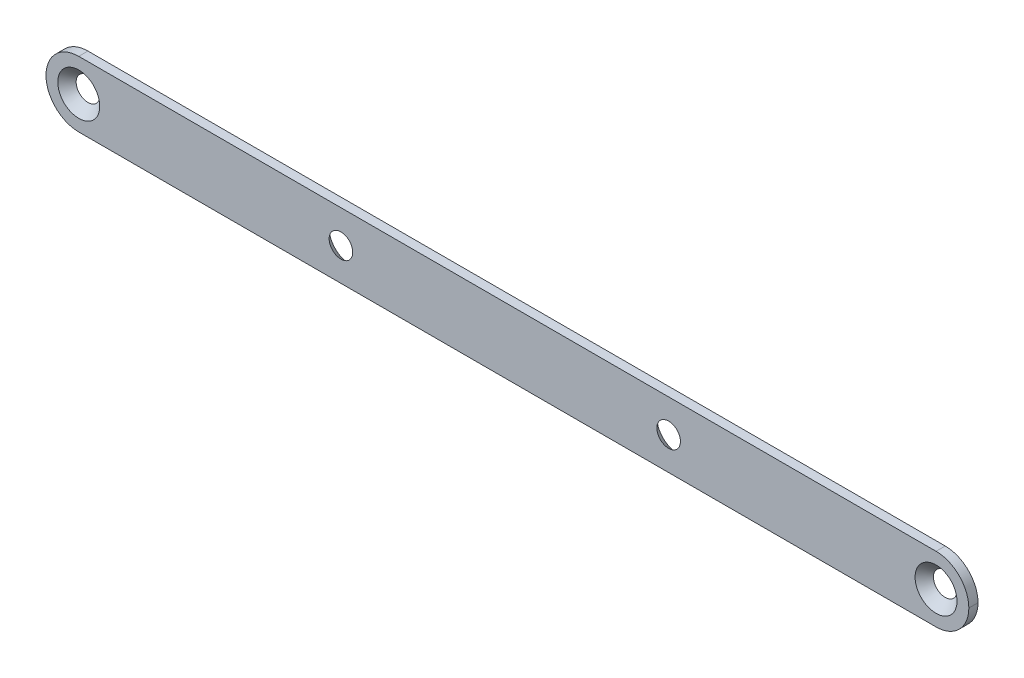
SolidWorks part; units mm, degrees
ref_plane "Front Plane" through (0, 0, 0) normal (0, 0, 1) x (1, 0, 0)
ref_plane "Top Plane" through (0, 0, 0) normal (0, 1, 0) x (1, 0, 0)
ref_plane "Right Plane" through (0, 0, 0) normal (1, 0, 0) x (0, 0, -1)
sketch "Sketch1" plane through (0, 0, 0) normal (0, 0, 1) x (1, 0, 0)
  line L1 (-21.9446, 5.3571) -> (118.8554, 5.3571)
  line L2 (-21.9446, 5.3571) -> (-21.9446, -4.6429)
  line L3 (-21.9446, -4.6429) -> (118.8554, -4.6429)
  line L4 (118.8554, 5.3571) -> (118.8554, -4.6429)
  circle A0 centre (-16.9446, 0.3571) radius 1.7
  circle A1 centre (113.8554, 0.3571) radius 1.7
  circle A2 centre (23.0554, 0.3571) radius 1.7
  circle A3 centre (73.0554, 0.3571) radius 1.7
  dimension "D3" = 3.4
  dimension "D4" = 3.4
  dimension "D9" = 3.4
  dimension "D10" = 3.4
  dimension "D1" = 10
  dimension "D2" = 140.8
  dimension "D5" = 5
  dimension "D6" = 5
  dimension "D7" = 5
  dimension "D8" = 5
  dimension "D11" = 5
  dimension "D12" = 5
  dimension "D13" = 50
  dimension "D14" = 40
extrude "Boss-Extrude1" add sketch "Sketch1" along normal blind 1.4
hole_wizard "CSK for M3 Flat Head Machine Screw1" positions "Sketch2" profile "Sketch3" countersink size "M3" standard "ANSI Metric"
sketch "Sketch2" plane through (0, 0, 1.4) normal (0, 0, 1) x (1, 0, 0)
  point P0 (-16.9446, 0.3571)
  point P3 (113.8554, 0.3571)
sketch "Sketch3" plane through (-16.9446, 0.3571, 1.4) normal (1, 0, 0) x (0, -1, 0)
  line L0 (0, 0) -> (0, 15.0215)
  line L1 (0, 15.0215) -> (1.7, 14)
  line L2 (1.7, 14) -> (1.7, 1.5)
  line L3 (1.7, 1.5) -> (3.2, 0)
  line L5 (3.2, 0) -> (0, 0)
  line L6 (-1.7, 1.5) -> (-3.2, 0) construction
  line L10 (0, 15.0215) -> (-1.7, 14) construction
  line L11 (0, -6.35) -> (0, 107.95) construction
  dimension "Hole Dia." = 3.4
  dimension "Hole Depth" = 14
  dimension "Near C'Sink Dia." = 6.4
  dimension "Near C'Sink Angle" = 90
  dimension "Drill Angle" = 118
hole_wizard "CSK for M3 Flat Head Machine Screw2" positions "Sketch4" profile "Sketch5" countersink size "M3" standard "ANSI Metric"
sketch "Sketch4" plane through (0, 0, 0) normal (0, 0, -1) x (-1, 0, 0)
  point P0 (-73.0554, 0.3571)
  point P3 (-23.0554, 0.3571)
sketch "Sketch5" plane through (73.0554, 0.3571, 0) normal (1, 0, 0) x (0, 1, 0)
  line L0 (0, 0) -> (0, 15.0215)
  line L1 (0, 15.0215) -> (1.7, 14)
  line L2 (1.7, 14) -> (1.7, 1.5)
  line L3 (1.7, 1.5) -> (3.2, 0)
  line L5 (3.2, 0) -> (0, 0)
  line L6 (-1.7, 1.5) -> (-3.2, 0) construction
  line L10 (0, 15.0215) -> (-1.7, 14) construction
  line L11 (0, -6.35) -> (0, 107.95) construction
  dimension "Hole Dia." = 3.4
  dimension "Hole Depth" = 14
  dimension "Near C'Sink Dia." = 6.4
  dimension "Near C'Sink Angle" = 90
  dimension "Drill Angle" = 118
fillet "Fillet1" radius 5 4 edges at (-21.9446, 5.3571, 0.7) (-21.9446, -4.6429, 0.7) (118.8554, 5.3571, 0.7) (118.8554, -4.6429, 0.7)
ref_plane "Plane1" through (0, 0, 1.4) normal (0, 0, 1) x (1, 0, 0)
